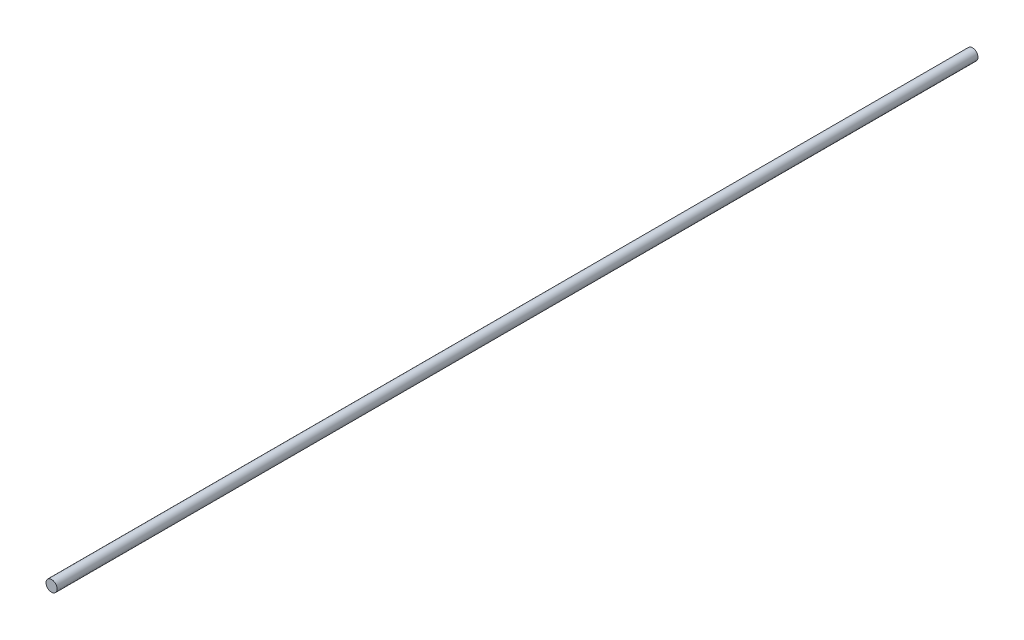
SolidWorks part; units mm, degrees
ref_plane "Front Plane" through (0, 0, 0) normal (0, 0, 1) x (1, 0, 0)
ref_plane "Top Plane" through (0, 0, 0) normal (0, 1, 0) x (1, 0, 0)
ref_plane "Right Plane" through (0, 0, 0) normal (1, 0, 0) x (0, 0, -1)
sketch "Sketch1" plane through (0, 0, 0) normal (0, 0, 1) x (1, 0, 0)
  circle A0 centre (0, 0) radius 6.35
  dimension "D1" = 12.7
extrude "Extrude1" add sketch "Sketch1" along normal blind 1054.1
